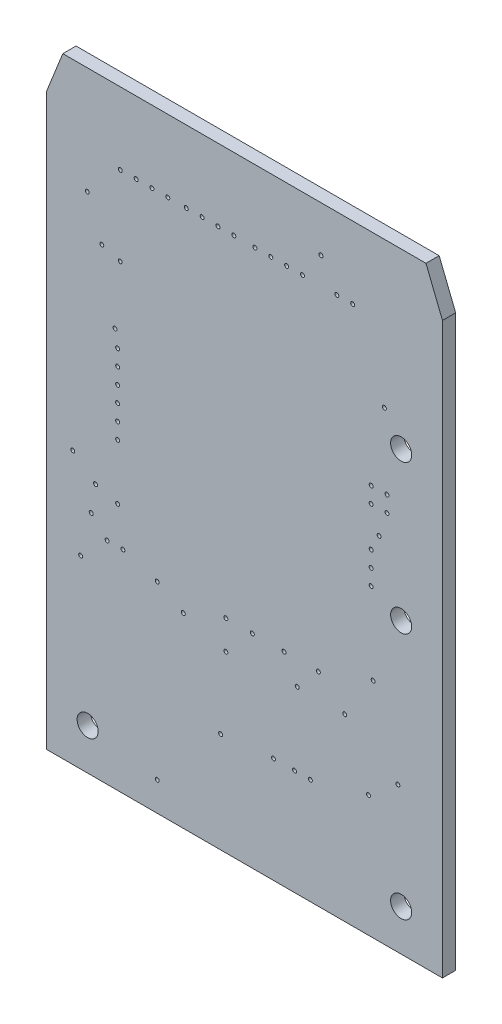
SolidWorks part; units mm, degrees
ref_plane "Front Plane" through (0, 0, 0) normal (0, 0, 1) x (1, 0, 0)
ref_plane "Top Plane" through (0, 0, 0) normal (0, 1, 0) x (1, 0, 0)
ref_plane "Right Plane" through (0, 0, 0) normal (1, 0, 0) x (0, 0, -1)
ref_plane "Dielectric_Layer Layer 1" through (0, 0, 0.508) normal (0, 0, 1) x (1, 0, 0)
sketch "Sketch1" plane through (0, 0, 0) normal (0, 0, 1) x (1, 0, 0)
  line L0 (0, 0) -> (0, 21.9075)
  line L1 (0, 21.9075) -> (0.635, 23.495)
  line L2 (0.635, 23.495) -> (14.605, 23.495)
  line L3 (14.605, 23.495) -> (15.24, 21.9075)
  line L4 (15.24, 21.9075) -> (15.24, 0)
  line L5 (15.24, 0) -> (0, 0)
extrude "Board_Outline" add sketch "Sketch1" along normal blind 0.508 separate body
sketch "Sketch2" plane through (0, 0, 0) normal (0, 0, 1) x (1, 0, 0)
  circle A0 centre (13.0048, 17.8816) radius 0.0762
  circle A1 centre (13.1064, 15.0368) radius 0.0762
  circle A2 centre (12.573, 8.5725) radius 0.0762
  circle A3 centre (13.5255, 5.588) radius 0.0762
  circle A4 centre (5.2705, 7.1755) radius 0.0762
  circle A5 centre (1.5748, 19.3675) radius 0.0762
  circle A6 centre (1.8923, 9.779) radius 0.0762
  circle A7 centre (2.1336, 17.8816) radius 0.0762
  circle A8 centre (3.4544, 20.7264) radius 0.0762
  circle A9 centre (2.6416, 15.3416) radius 0.0762
  circle A10 centre (2.8448, 20.7264) radius 0.0762
  circle A11 centre (2.8448, 17.6784) radius 0.0762
  circle A12 centre (4.064, 20.7264) radius 0.0762
  circle A13 centre (2.7432, 14.732) radius 0.0762
  circle A14 centre (4.6736, 20.7264) radius 0.0762
  circle A15 centre (2.7432, 14.1224) radius 0.0762
  circle A16 centre (5.3848, 20.7264) radius 0.0762
  circle A17 centre (2.7432, 13.5128) radius 0.0762
  circle A18 centre (5.9944, 20.7264) radius 0.0762
  circle A19 centre (2.7432, 12.9032) radius 0.0762
  circle A20 centre (6.604, 20.7264) radius 0.0762
  circle A21 centre (2.7432, 12.2936) radius 0.0762
  circle A22 centre (7.2136, 20.7264) radius 0.0762
  circle A23 centre (2.7432, 11.684) radius 0.0762
  circle A24 centre (8.0264, 20.7264) radius 0.0762
  circle A25 centre (12.4968, 11.684) radius 0.0762
  circle A26 centre (11.7856, 20.7264) radius 0.0762
  circle A27 centre (12.4968, 15.0368) radius 0.0762
  circle A28 centre (11.176, 20.7264) radius 0.0762
  circle A29 centre (12.4968, 14.4272) radius 0.0762
  circle A30 centre (10.5664, 21.7424) radius 0.0762
  circle A31 centre (13.1064, 14.4272) radius 0.0762
  circle A32 centre (9.8552, 20.7264) radius 0.0762
  circle A33 centre (12.8016, 13.5128) radius 0.0762
  circle A34 centre (9.2456, 20.7264) radius 0.0762
  circle A35 centre (12.4968, 12.9032) radius 0.0762
  circle A36 centre (8.636, 20.7264) radius 0.0762
  circle A37 centre (12.4968, 12.2936) radius 0.0762
  circle A38 centre (6.9088, 7.8232) radius 0.0762
  circle A39 centre (8.7376, 4.064) radius 0.0762
  circle A40 centre (6.7056, 3.8608) radius 0.0762
  circle A41 centre (6.9088, 6.7056) radius 0.0762
  circle A42 centre (7.9248, 7.8232) radius 0.0762
  circle A43 centre (9.5504, 4.064) radius 0.0762
  circle A44 centre (12.3952, 4.6736) radius 0.0762
  circle A45 centre (9.652, 6.9088) radius 0.0762
  circle A46 centre (10.16, 4.064) radius 0.0762
  circle A47 centre (9.144, 7.8232) radius 0.0762
  circle A48 centre (10.4648, 7.8232) radius 0.0762
  circle A49 centre (11.4808, 6.9088) radius 0.0762
  circle A50 centre (2.7432, 9.5504) radius 0.0762
  circle A51 centre (1.3208, 7.112) radius 0.0762
  circle A52 centre (2.9464, 8.128) radius 0.0762
  circle A53 centre (1.016, 10.4648) radius 0.0762
  circle A54 centre (1.7272, 8.7376) radius 0.0762
  circle A55 centre (2.3368, 8.128) radius 0.0762
  circle A56 centre (4.2672, 1.1176) radius 0.0762
  circle A57 centre (4.2672, 7.7216) radius 0.0762
extrude "NPTH" cut sketch "Sketch2" along normal through all
sketch "Sketch3" plane through (0, 0, 0) normal (0, 0, 1) x (1, 0, 0)
  circle A0 centre (13.65, 1.59) radius 0.405
  circle A1 centre (1.59, 1.59) radius 0.405
  circle A2 centre (13.65, 16.83) radius 0.405
  circle A3 centre (13.65, 11.11) radius 0.405
extrude "PTH" cut sketch "Sketch3" along normal through all
